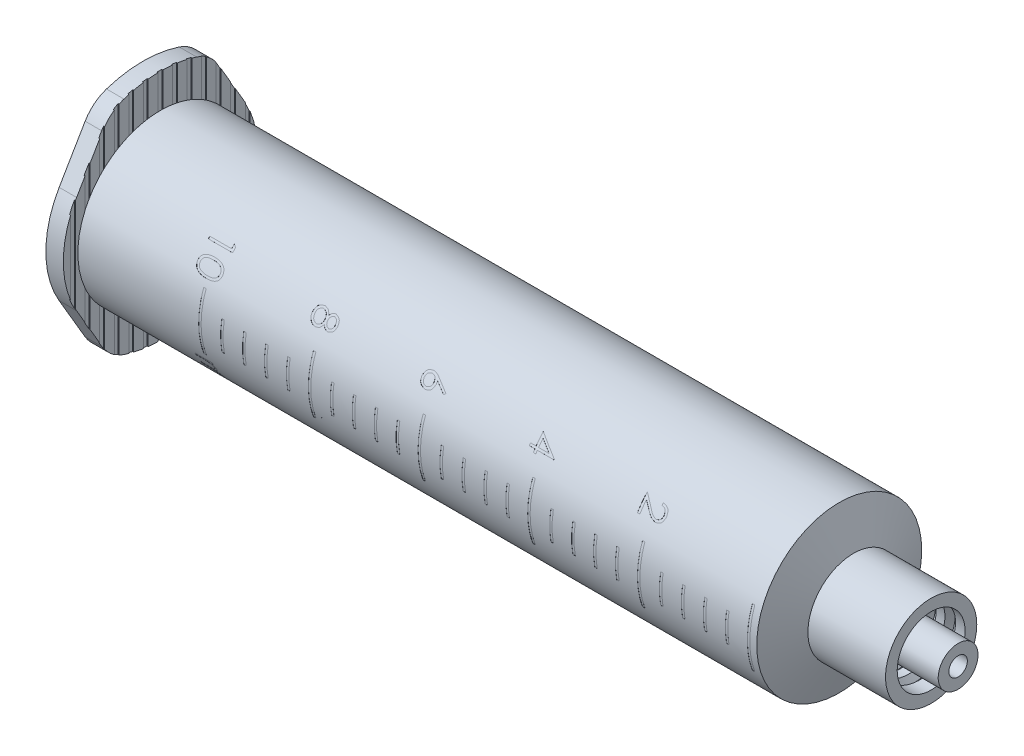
SolidWorks part; units mm, degrees
ref_plane "Front Plane" through (0, 0, 0) normal (0, 0, 1) x (1, 0, 0)
ref_plane "Top Plane" through (0, 0, 0) normal (0, 1, 0) x (1, 0, 0)
ref_plane "Right Plane" through (0, 0, 0) normal (1, 0, 0) x (0, 0, -1)
sketch "Sketch1" plane through (0, 0, 0) normal (0, 0, 1) x (1, 0, 0)
  line L0 (103.5215, 0) -> (-103.5215, 0) construction
  line L1 (0, 7.3) -> (0, 12)
  line L2 (0, 12) -> (1.8, 12)
  line L3 (1.8, 12) -> (1.8, 8.5)
  line L4 (1.8, 8.5) -> (71.75, 8.5)
  line L5 (71.75, 8.5) -> (73.2229, 4.7)
  line L10 (74.25, 2.05) -> (84, 2.05)
  line L11 (84, 2.05) -> (84, 0.95)
  line L12 (84, 0.95) -> (73.5388, 0.95)
  line L13 (73.5388, 0.95) -> (71, 7.5)
  line L14 (71, 7.5) -> (5, 7.5)
  line L15 (5, 7.5) -> (5, 7.3)
  line L16 (5, 7.3) -> (0, 7.3)
  line L17 (73.2229, 4.7) -> (81.2229, 4.7)
  line L18 (81.2229, 4.7) -> (81.2229, 3.5)
  line L19 (81.2229, 3.5) -> (73.688, 3.5)
  line L20 (73.688, 3.5) -> (74.25, 2.05)
  point P4 (0, 0)
  dimension "D1" = 24
  dimension "D2" = 17
  dimension "D3" = 15
  dimension "D4" = 14.6
  dimension "D5" = 5
  dimension "D6" = 1.8
  dimension "D7" = 84
  dimension "D8" = 9.75
  dimension "D9" = 71.75
  dimension "D10" = 111.186
  dimension "D11" = 9.4
  dimension "D12" = 4.1
  dimension "D13" = 1.9
  dimension "D14" = 7
  dimension "D15" = 71
  dimension "D16" = 8
revolve "Revolve1" add sketch "Sketch1" angle 360 about L0
sketch "Sketch9"
  dimension "D1" = 0.5
  dimension "D2" = 16
  dimension "D3" = 16
extrude "Cut-Extrude2" cut sketch "Sketch9" against normal blind 0.1
sketch "Sketch7" plane through (0, 0, 0) normal (-1, 0, 0) x (0, 0, 1)
  line L0 (0, 22.4439) -> (0, -22.4439) construction
  line L1 (14.7478, 0) -> (-14.7478, 0) construction
  line L2 (-8.6269, -5.0574) -> (-5.9507, -9.6223)
  line L3 (-8.6269, 5.0574) -> (-5.9507, 9.6223)
  line L4 (8.6269, 5.0574) -> (5.9507, 9.6223)
  line L5 (8.6269, -5.0574) -> (5.9507, -9.6223)
  circle A0 centre (0, 0) radius 12 construction
  arc A1 (-3.75, -11.399) -> (3.75, -11.399) centre (0, 0) ccw
  arc A2 (8.6269, -5.0574) -> (8.6269, 5.0574) centre (0, 0) ccw
  arc A3 (-5.9507, -9.6223) -> (-3.75, -11.399) centre (-2.5, -7.5993) ccw
  arc A4 (-5.9507, 9.6223) -> (-3.75, 11.399) centre (-2.5, 7.5993) cw
  arc A5 (5.9507, 9.6223) -> (3.75, 11.399) centre (2.5, 7.5993) ccw
  arc A6 (5.9507, -9.6223) -> (3.75, -11.399) centre (2.5, -7.5993) cw
  arc A7 (3.75, 11.399) -> (-3.75, 11.399) centre (0, 0) ccw
  arc A8 (-8.6269, 5.0574) -> (-8.6269, -5.0574) centre (0, 0) ccw
  point P6 (0, 0)
  point P9 (0, 0)
  dimension "D1" = 4
  dimension "D2" = 5
  dimension "D3" = 10
extrude "Cut-Extrude1" cut sketch "Sketch7" against normal up to next flip side to cut
fillet "Fillet1" radius 5 1 edges at (5, 0, -7.3)
sketch "Sketch8" plane through (0, 0, 0) normal (0, 0, 1) x (1, 0, 0)
  line L0 (0, 0) -> (147.0884, 0) construction
  line L1 (71, 7.5) -> (71, -7.5) construction
  line L2 (70.75, 3) -> (71, 3)
  line L3 (70.75, 3) -> (70.75, -3)
  line L4 (70.75, -3) -> (71, -3)
  line L5 (71, 3) -> (71, -3)
  line L6 (70.75, 3) -> (71, -3) construction
  line L7 (70.75, -3) -> (71, 3) construction
  line L8 (59.45, 3) -> (59.45, -3)
  line L9 (59.45, -3) -> (59.7, -3)
  line L10 (59.7, 3) -> (59.7, -3)
  line L11 (59.45, 3) -> (59.7, 3)
  line L12 (48.15, 3) -> (48.15, -3)
  line L13 (48.15, -3) -> (48.4, -3)
  line L14 (48.4, 3) -> (48.4, -3)
  line L15 (48.15, 3) -> (48.4, 3)
  line L16 (36.85, 3) -> (36.85, -3)
  line L17 (36.85, -3) -> (37.1, -3)
  line L18 (37.1, 3) -> (37.1, -3)
  line L19 (36.85, 3) -> (37.1, 3)
  line L20 (25.55, 3) -> (25.55, -3)
  line L21 (25.55, -3) -> (25.8, -3)
  line L22 (25.8, 3) -> (25.8, -3)
  line L23 (25.55, 3) -> (25.8, 3)
  line L32 (66.23, 1.5) -> (66.23, -1.5)
  line L33 (68.49, 1.5) -> (68.74, 1.5)
  line L34 (68.49, 1.5) -> (68.49, -1.5)
  line L35 (68.49, -1.5) -> (68.74, -1.5)
  line L36 (68.74, 1.5) -> (68.74, -1.5)
  line L37 (68.49, 1.5) -> (68.74, -1.5) construction
  line L38 (68.49, -1.5) -> (68.74, 1.5) construction
  line L39 (66.23, -1.5) -> (66.48, -1.5)
  line L40 (66.48, 1.5) -> (66.48, -1.5)
  line L41 (66.23, 1.5) -> (66.48, 1.5)
  line L42 (63.97, 1.5) -> (63.97, -1.5)
  line L43 (63.97, -1.5) -> (64.22, -1.5)
  line L44 (64.22, 1.5) -> (64.22, -1.5)
  line L45 (63.97, 1.5) -> (64.22, 1.5)
  line L46 (61.71, 1.5) -> (61.71, -1.5)
  line L47 (61.71, -1.5) -> (61.96, -1.5)
  line L48 (61.96, 1.5) -> (61.96, -1.5)
  line L49 (61.71, 1.5) -> (61.96, 1.5)
  line L50 (59.45, 1.5) -> (59.45, -1.5)
  line L51 (59.45, -1.5) -> (59.7, -1.5)
  line L52 (59.7, 1.5) -> (59.7, -1.5)
  line L53 (59.45, 1.5) -> (59.7, 1.5)
  line L54 (57.19, 1.5) -> (57.19, -1.5)
  line L55 (57.19, -1.5) -> (57.44, -1.5)
  line L56 (57.44, 1.5) -> (57.44, -1.5)
  line L57 (57.19, 1.5) -> (57.44, 1.5)
  line L58 (54.93, 1.5) -> (54.93, -1.5)
  line L59 (54.93, -1.5) -> (55.18, -1.5)
  line L60 (55.18, 1.5) -> (55.18, -1.5)
  line L61 (54.93, 1.5) -> (55.18, 1.5)
  line L62 (52.67, 1.5) -> (52.67, -1.5)
  line L63 (52.67, -1.5) -> (52.92, -1.5)
  line L64 (52.92, 1.5) -> (52.92, -1.5)
  line L65 (52.67, 1.5) -> (52.92, 1.5)
  line L66 (50.41, 1.5) -> (50.41, -1.5)
  line L67 (50.41, -1.5) -> (50.66, -1.5)
  line L68 (50.66, 1.5) -> (50.66, -1.5)
  line L69 (50.41, 1.5) -> (50.66, 1.5)
  line L70 (48.15, 1.5) -> (48.15, -1.5)
  line L71 (48.15, -1.5) -> (48.4, -1.5)
  line L72 (48.4, 1.5) -> (48.4, -1.5)
  line L73 (48.15, 1.5) -> (48.4, 1.5)
  line L74 (45.89, 1.5) -> (45.89, -1.5)
  line L75 (45.89, -1.5) -> (46.14, -1.5)
  line L76 (46.14, 1.5) -> (46.14, -1.5)
  line L77 (45.89, 1.5) -> (46.14, 1.5)
  line L78 (43.63, 1.5) -> (43.63, -1.5)
  line L79 (43.63, -1.5) -> (43.88, -1.5)
  line L80 (43.88, 1.5) -> (43.88, -1.5)
  line L81 (43.63, 1.5) -> (43.88, 1.5)
  line L82 (41.37, 1.5) -> (41.37, -1.5)
  line L83 (41.37, -1.5) -> (41.62, -1.5)
  line L84 (41.62, 1.5) -> (41.62, -1.5)
  line L85 (41.37, 1.5) -> (41.62, 1.5)
  line L86 (39.11, 1.5) -> (39.11, -1.5)
  line L87 (39.11, -1.5) -> (39.36, -1.5)
  line L88 (39.36, 1.5) -> (39.36, -1.5)
  line L89 (39.11, 1.5) -> (39.36, 1.5)
  line L90 (36.85, 1.5) -> (36.85, -1.5)
  line L91 (36.85, -1.5) -> (37.1, -1.5)
  line L92 (37.1, 1.5) -> (37.1, -1.5)
  line L93 (36.85, 1.5) -> (37.1, 1.5)
  line L94 (34.59, 1.5) -> (34.59, -1.5)
  line L95 (34.59, -1.5) -> (34.84, -1.5)
  line L96 (34.84, 1.5) -> (34.84, -1.5)
  line L97 (34.59, 1.5) -> (34.84, 1.5)
  line L98 (32.33, 1.5) -> (32.33, -1.5)
  line L99 (32.33, -1.5) -> (32.58, -1.5)
  line L100 (32.58, 1.5) -> (32.58, -1.5)
  line L101 (32.33, 1.5) -> (32.58, 1.5)
  line L102 (30.07, 1.5) -> (30.07, -1.5)
  line L103 (30.07, -1.5) -> (30.32, -1.5)
  line L104 (30.32, 1.5) -> (30.32, -1.5)
  line L105 (30.07, 1.5) -> (30.32, 1.5)
  line L106 (27.81, 1.5) -> (27.81, -1.5)
  line L107 (27.81, -1.5) -> (28.06, -1.5)
  line L108 (28.06, 1.5) -> (28.06, -1.5)
  line L109 (27.81, 1.5) -> (28.06, 1.5)
  line L110 (25.55, 1.5) -> (25.55, -1.5)
  line L111 (25.55, -1.5) -> (25.8, -1.5)
  line L112 (25.8, 1.5) -> (25.8, -1.5)
  line L113 (25.55, 1.5) -> (25.8, 1.5)
  line L130 (13, -3) -> (13, -8) construction
  line L131 (23.29, 1.5) -> (23.29, -1.5)
  line L132 (23.29, -1.5) -> (23.54, -1.5)
  line L133 (23.54, 1.5) -> (23.54, -1.5)
  line L150 (23.29, 1.5) -> (23.54, 1.5)
  line L151 (21.03, 1.5) -> (21.03, -1.5)
  line L152 (21.03, -1.5) -> (21.28, -1.5)
  line L153 (21.28, 1.5) -> (21.28, -1.5)
  line L154 (58.2, 3) -> (58.2, 8) construction
  line L155 (46.9, 3) -> (46.9, 8) construction
  line L156 (35.6, 3) -> (35.6, 8) construction
  line L157 (24.3, 3) -> (24.3, 8) construction
  line L158 (21.03, 1.5) -> (21.28, 1.5)
  line L159 (18.77, 1.5) -> (18.77, -1.5)
  line L160 (18.77, -1.5) -> (19.02, -1.5)
  line L161 (19.02, 1.5) -> (19.02, -1.5)
  line L162 (18.77, 1.5) -> (19.02, 1.5)
  line L163 (16.51, 1.5) -> (16.51, -1.5)
  line L164 (16.51, -1.5) -> (16.76, -1.5)
  line L165 (16.76, 1.5) -> (16.76, -1.5)
  line L166 (16.51, 1.5) -> (16.76, 1.5)
  line L171 (13, 3) -> (13, 8) construction
  line L172 (14.25, 3) -> (14.25, -3)
  line L173 (14.25, -3) -> (14.5, -3)
  line L174 (14.5, 3) -> (14.5, -3)
  line L175 (14.25, 3) -> (14.5, 3)
  line L176 (14.25, 1.5) -> (14.5, 1.5)
  line L177 (14.25, 1.5) -> (14.25, -1.5)
  line L178 (14.25, -1.5) -> (14.5, -1.5)
  line L179 (14.5, 1.5) -> (14.5, -1.5)
  text T0 "2" font "Century Gothic" height 2.5
  text T1 "4" font "Century Gothic" height 2.5
  text T2 "6" font "Century Gothic" height 2.5
  text T3 "8" font "Century Gothic" height 2.5
  text T4 "ml" font "Century Gothic" height 2.5
  text T5 "10" font "Century Gothic" height 2.5
  point P3 (70.875, 0)
  point P10 (68.615, 0)
wrap "Wrap1" sketch "Sketch8" wrap type deboss source sketch "Sketch8" thickness 0.01 parameters "D1"=0.01
thread "Thread1" pitch 1.25 start angle 0, offset 0, length 7, pitch 2, diameter 7
ref_plane "Plane1" through (81.2229, 0, 3.5) normal (0, -1, 0) x (0, 0, 1)
sketch "Thread Profile1" plane through (81.2229, 0, 3.5) normal (0, -1, 0) x (0, 0, 1)
  line L0 (0, 0) -> (0, 1.25) construction
  line L11 (0, 1.0938) -> (0, 0)
  line L12 (0, 0) -> (0.6766, 0.3906)
  line L13 (0.6766, 0.3906) -> (0.6766, 0.7031)
  line L15 (0.6766, 0.7031) -> (0, 1.0938)
  line L17 (0.6766, 0.5469) -> (0, 0.5469) construction
  point P3 (0, 0)
  dimension "Pitch" = 1.25
  dimension "Profile_Angle" = 60
  dimension "Profile_Land" = 0.3125
  dimension "Profile_Height" = 0.6766
equation "\"D7@Sketch8\"=\"D5@Sketch8\""
equation "\"D5@Sketch8\"=\"D8@Sketch8\"/5"
